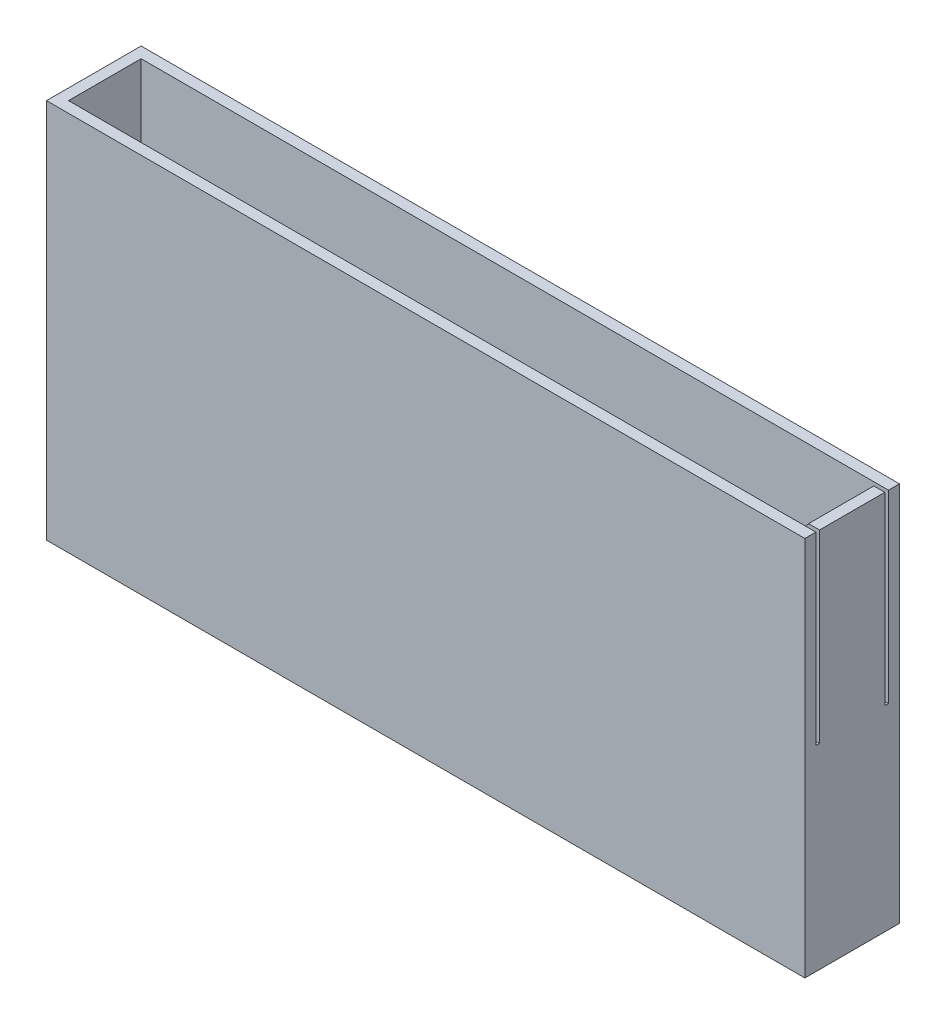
SolidWorks part; units mm, degrees
ref_plane "Front Plane" through (0, 0, 0) normal (0, 0, 1) x (1, 0, 0)
ref_plane "Top Plane" through (0, 0, 0) normal (0, 1, 0) x (1, 0, 0)
ref_plane "Right Plane" through (0, 0, 0) normal (1, 0, 0) x (0, 0, -1)
sketch "Sketch1" plane through (0, 0, 0) normal (0, 1, 0) x (1, 0, 0)
  line L1 (0, 0) -> (103.4, 0)
  line L2 (0, 0) -> (0, 12.9)
  line L3 (0, 12.9) -> (103.4, 12.9)
  line L4 (103.4, 0) -> (103.4, 12.9)
  line L5 (1.5, 1.5) -> (101.9, 1.5)
  line L6 (1.5, 1.5) -> (1.5, 11.4)
  line L7 (1.5, 11.4) -> (101.9, 11.4)
  line L8 (101.9, 1.5) -> (101.9, 11.4)
  dimension "D1" = 1.5
  dimension "D2" = 1.5
  dimension "D3" = 1.5
  dimension "D4" = 1.5
  dimension "D5" = 9.9
  dimension "D6" = 100.4
extrude "Boss-Extrude1" add sketch "Sketch1" along normal blind 50.4
sketch "Sketch2" plane through (0, 0, 0) normal (0, -1, 0) x (-1, 0, 0)
  line L1 (0, 0) -> (-103.4, 0)
  line L2 (0, 0) -> (0, 12.9)
  line L3 (0, 12.9) -> (-103.4, 12.9)
  line L4 (-103.4, 0) -> (-103.4, 12.9)
extrude "Boss-Extrude2" add sketch "Sketch2" along normal blind 1.5
sketch "Sketch3" plane through (0, 0, 0) normal (0, 1, 0) x (1, 0, 0)
  line L0 (101.9, 11.4) -> (1.5, 11.4) construction
  line L1 (10.5, 11.4) -> (92.9, 11.4)
  line L2 (10.5, 11.4) -> (10.5, 1.5)
  line L3 (10.5, 1.5) -> (92.9, 1.5)
  line L4 (92.9, 11.4) -> (92.9, 1.5)
  line L5 (1.5, 1.5) -> (101.9, 1.5) construction
  line L6 (1.5, 11.4) -> (1.5, 1.5) construction
  line L7 (101.9, 1.5) -> (101.9, 11.4) construction
  dimension "D1" = 9
  dimension "D2" = 9
extrude "Cut-Extrude1" cut sketch "Sketch3" against normal up to surface (1.5 mm away)
sketch "Sketch6" plane through (101.9, 0, 0) normal (-1, 0, 0) x (0, 0, 1)
  line L0 (-1.5, 25.2) -> (-11.4, 25.2) construction
  line L1 (-1.5, 50.4) -> (-1.5, 0) construction
  line L2 (-11.4, 50.4) -> (-11.4, 0) construction
  line L3 (-1.5, 50.4) -> (-11.4, 50.4) construction
  line L4 (-11.4, 25.2) -> (-10.9, 25.2)
  line L5 (-11.4, 25.2) -> (-11.4, 50.4)
  line L6 (-11.4, 50.4) -> (-10.9, 50.4)
  line L7 (-10.9, 25.2) -> (-10.9, 50.4)
  line L9 (-1.5, 25.2) -> (-2, 25.2)
  line L10 (-1.5, 25.2) -> (-1.5, 50.4)
  line L11 (-1.5, 50.4) -> (-2, 50.4)
  line L12 (-2, 25.2) -> (-2, 50.4)
  dimension "D1" = 0.5
  dimension "D2" = 0.5
extrude "Cut-Extrude3" cut sketch "Sketch6" against normal up to surface (1.5 mm away)
sketch "Sketch8" plane through (0, 0, -2) normal (0, 0, 1) x (1, 0, 0)
  line L0 (101.9, 50.4) -> (100.9, 49.15)
  line L1 (100.9, 49.15) -> (101.9, 47.9)
  line L2 (101.9, 50.4) -> (101.9, 25.2) construction
  line L3 (101.9, 47.9) -> (101.9, 50.4)
  dimension "D1" = 1
  dimension "D2" = 2.5
  dimension "D3" = 1.25
extrude "Boss-Extrude4" add sketch "Sketch8" against normal up to surface (8.9 mm away)
equation "\"D2@Sketch1\"=\"D1@Sketch1\""
equation "\"D3@Sketch1\"=\"D1@Sketch1\""
equation "\"D4@Sketch1\"=\"D3@Sketch1\""
equation "\"D2@Sketch3\"=\"D1@Sketch3\""
equation "\"D2@Sketch6\"=\"D1@Sketch6\""
equation "\"D3@Sketch8\"=\"D2@Sketch8\"/2"
